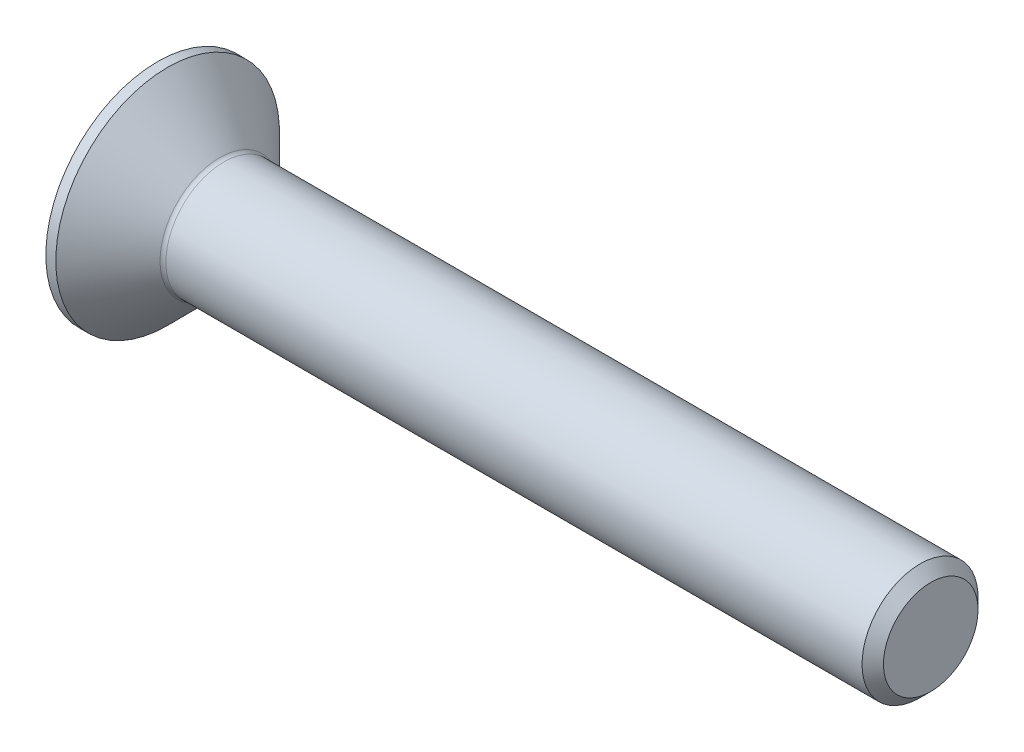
SolidWorks part; units mm, degrees
ref_plane "Спереди" through (0, 0, 0) normal (0, 0, 1) x (1, 0, 0)
ref_plane "Сверху" through (0, 0, 0) normal (0, 1, 0) x (1, 0, 0)
ref_plane "Справа" through (0, 0, 0) normal (1, 0, 0) x (0, 0, -1)
sketch "Эскиз1" plane through (0, 0, 0) normal (0, 0, 1) x (1, 0, 0)
  line L0 (0, 5.785) -> (0.515, 5.785)
  line L1 (0.515, 5.785) -> (3.2121, 3.0879)
  line L2 (3.4243, 3) -> (39.4455, 3)
  line L3 (39.4455, 3) -> (40, 2.4455)
  line L4 (40, 2.4455) -> (40, 0)
  line L5 (40, 0) -> (0, 0)
  line L6 (0, 0) -> (0, 5.785)
  arc A0 (3.2121, 3.0879) -> (3.4243, 3) centre (3.4243, 3.3) ccw
  point P9 (0, 0)
  point P10 (0, 0)
  point P11 (15.6563, 4.7317)
  dimension "D6" = 0.3
  dimension "D1" = 40
  dimension "D2" = 3
  dimension "D3" = 0.515
  dimension "D4" = 5.785
  dimension "D5" = 135
  dimension "D7" = 36.0212
revolve "Повернуть1" add sketch "Эскиз1" angle 360 about L5
sketch "Эскиз2" plane through (0, 0, 0) normal (-1, 0, 0) x (0, 0, 1)
  line L1 (2.01, -1.1605) -> (2.01, 1.1605)
  line L2 (2.01, 1.1605) -> (0, 2.3209)
  line L3 (0, 2.3209) -> (-2.01, 1.1605)
  line L4 (-2.01, 1.1605) -> (-2.01, -1.1605)
  line L5 (-2.01, -1.1605) -> (0, -2.3209)
  line L6 (0, -2.3209) -> (2.01, -1.1605)
  circle A0 centre (0, 0) radius 2.01 construction
  dimension "D1" = 4.02
extrude "Вырез-Вытянуть1" cut sketch "Эскиз2" against normal blind 2.5
sketch "Эскиз3" plane through (0, 0, 0) normal (0, 0, 1) x (1, 0, 0)
  line L0 (3.66, 0) -> (2.5, 2)
  line L1 (2.5, 2) -> (2.5, 0)
  line L2 (2.5, 0) -> (3.66, 0)
  line L3 (0, 5.785) -> (0, -5.785) construction
  point P6 (0, 0)
  dimension "D1" = 3.66
  dimension "D2" = 2
  dimension "D3" = 2.5
revolve "Вырез-Повернуть1" cut sketch "Эскиз3" angle 360 about L2
